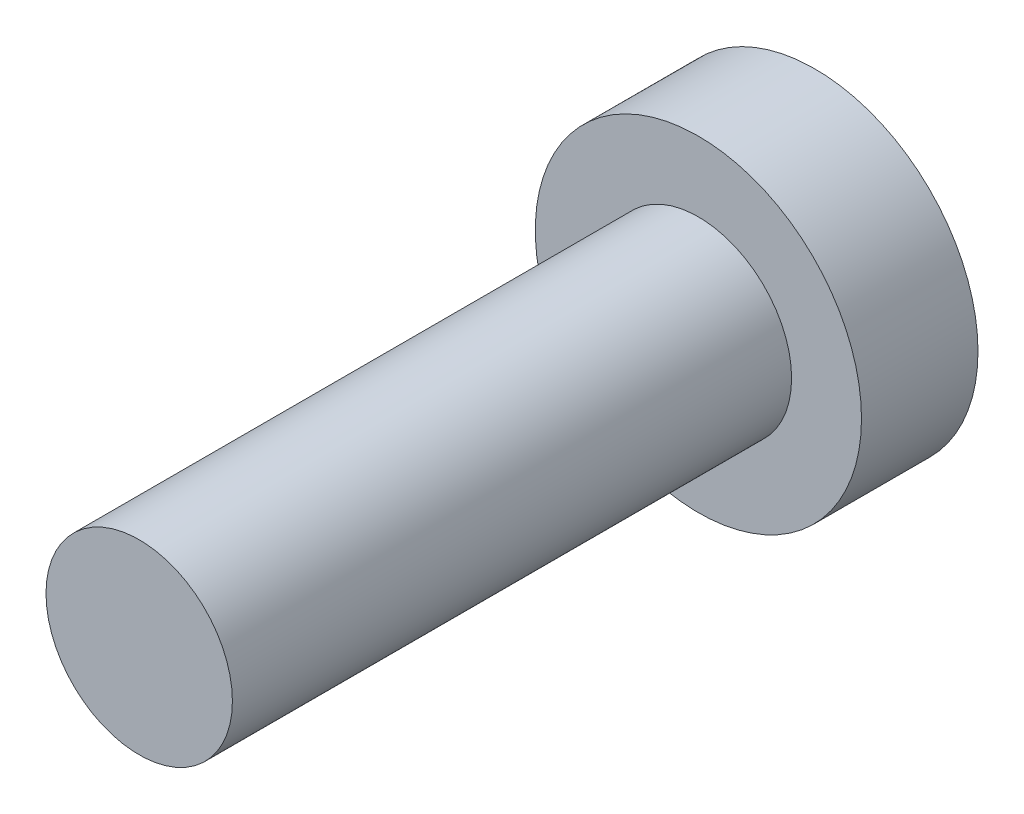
SolidWorks part; units mm, degrees
ref_plane "Plane1" through (0, 0, 0) normal (0, 0, 1) x (1, 0, 0)
ref_plane "Plane2" through (0, 0, 0) normal (0, 1, 0) x (1, 0, 0)
ref_plane "Plane3" through (0, 0, 0) normal (1, 0, 0) x (0, 0, -1)
sketch "Esquisse1" plane through (0, 0, 0) normal (0, 0, 1) x (1, 0, 0)
  circle A0 centre (0, 0) radius 2
  dimension "D1" = 4
extrude "BaseExtrusion" add sketch "Esquisse1" along normal blind 12
sketch "Esquisse2" plane through (0, 0, 0) normal (0, 0, -1) x (-1, 0, 0)
  circle A0 centre (0, 0) radius 3.5
  dimension "D1" = 7
extrude "Bossage-Extrusion1" add sketch "Esquisse2" along normal blind 2.5
